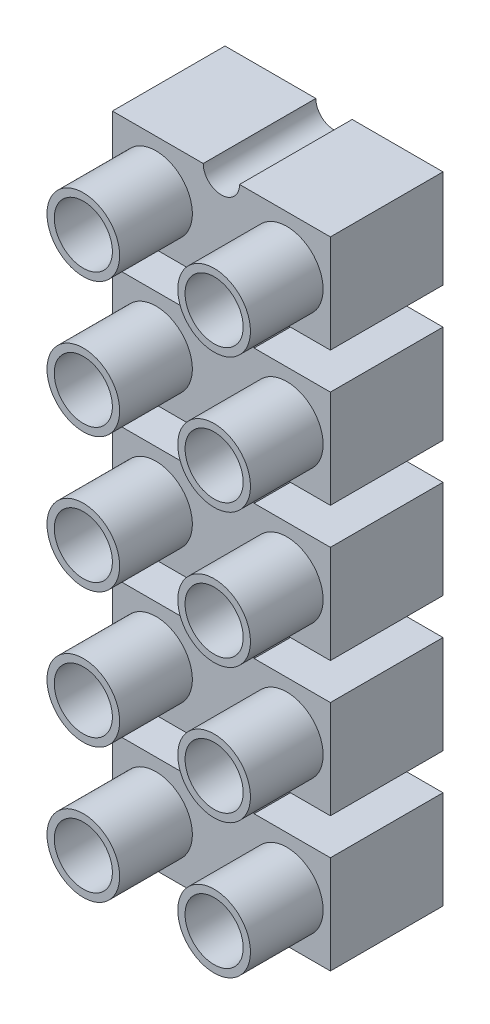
SolidWorks part; units mm, degrees
ref_plane "Plan1" through (0, 0, 0) normal (0, 0, 1) x (1, 0, 0)
ref_plane "Plan2" through (0, 0, 0) normal (0, 1, 0) x (1, 0, 0)
ref_plane "Plan3" through (0, 0, 0) normal (1, 0, 0) x (0, 0, -1)
sketch "Esquisse1" plane through (0, 0, 0) normal (0, 0, 1) x (1, 0, 0)
  line L0 (-15.0042, 29.0042) -> (-15.0042, -20.9546) construction
  line L1 (-22.5042, 29.0042) -> (-16.2542, 29.0042)
  line L2 (-12.7542, 19.7542) -> (-7.5042, 19.7542)
  line L3 (-7.5042, 29.0042) -> (-7.5042, 22.2542)
  line L4 (-7.5042, 22.2542) -> (-12.7542, 22.2542)
  line L5 (-12.7542, 22.2542) -> (-12.7542, 19.7542)
  line L6 (-17.2542, 19.7542) -> (-22.5042, 19.7542)
  line L7 (-17.2542, 22.2542) -> (-17.2542, 19.7542)
  line L8 (-22.5042, 22.2542) -> (-17.2542, 22.2542)
  line L9 (-22.5042, 29.0042) -> (-22.5042, 22.2542)
  line L10 (-7.5042, 19.7542) -> (-7.5042, 13.0042)
  line L11 (-7.5042, 13.0042) -> (-12.7542, 13.0042)
  line L12 (-12.7542, 13.0042) -> (-12.7542, 10.5042)
  line L13 (-12.7542, 10.5042) -> (-7.5042, 10.5042)
  line L14 (-22.5042, 19.7542) -> (-22.5042, 13.0042)
  line L15 (-22.5042, 13.0042) -> (-17.2542, 13.0042)
  line L16 (-17.2542, 13.0042) -> (-17.2542, 10.5042)
  line L17 (-17.2542, 10.5042) -> (-22.5042, 10.5042)
  line L18 (-7.5042, 10.5042) -> (-7.5042, 3.7542)
  line L19 (-7.5042, 3.7542) -> (-12.7542, 3.7542)
  line L20 (-12.7542, 3.7542) -> (-12.7542, 1.2542)
  line L21 (-12.7542, 1.2542) -> (-7.5042, 1.2542)
  line L22 (-22.5042, 10.5042) -> (-22.5042, 3.7542)
  line L23 (-22.5042, 3.7542) -> (-17.2542, 3.7542)
  line L24 (-17.2542, 3.7542) -> (-17.2542, 1.2542)
  line L25 (-17.2542, 1.2542) -> (-22.5042, 1.2542)
  line L26 (-7.5042, 1.2542) -> (-7.5042, -5.4958)
  line L27 (-7.5042, -5.4958) -> (-12.7542, -5.4958)
  line L28 (-12.7542, -5.4958) -> (-12.7542, -7.9958)
  line L29 (-12.7542, -7.9958) -> (-7.5042, -7.9958)
  line L30 (-22.5042, 1.2542) -> (-22.5042, -5.4958)
  line L31 (-22.5042, -5.4958) -> (-17.2542, -5.4958)
  line L32 (-17.2542, -5.4958) -> (-17.2542, -7.9958)
  line L33 (-17.2542, -7.9958) -> (-22.5042, -7.9958)
  line L34 (-7.5042, -7.9958) -> (-7.5042, -14.7458)
  line L35 (-7.5042, -14.7458) -> (-13.7542, -14.7458)
  line L36 (-13.7542, 29.0042) -> (-7.5042, 29.0042)
  line L37 (-15.0042, 21.0042) -> (-7.5042, 21.0042) construction
  line L38 (-22.5042, -7.9958) -> (-22.5042, -14.7458)
  line L39 (-15.0042, 21.0042) -> (-22.5042, 21.0042) construction
  line L40 (-16.2542, -14.7458) -> (-22.5042, -14.7458)
  circle A0 centre (-15.0042, 21.0042) radius 1.25
  circle A1 centre (-15.0042, 11.7542) radius 1.25
  circle A2 centre (-15.0042, 2.5042) radius 1.25
  circle A3 centre (-15.0042, -6.7458) radius 1.25
  arc A4 (-16.2542, 29.0042) -> (-13.7542, 29.0042) centre (-15.0042, 29.0042) ccw
  arc A5 (-13.7542, -14.7458) -> (-16.2542, -14.7458) centre (-15.0042, -14.7458) ccw
  dimension "D7" = 2.5
  dimension "D1" = 6.75
  dimension "D2" = 2.5
  dimension "D3" = 43.75
  dimension "D4" = 15
  dimension "D5" = 8
  dimension "D6" = 5.25
extrude "Base-Extrusion" add sketch "Esquisse1" along normal blind 7.75
sketch "Esquisse2" plane through (0, 0, 7.75) normal (0, 0, 1) x (1, 0, 0)
  line L0 (-16.2542, 29.0042) -> (-22.5042, 29.0042) construction
  line L1 (-15.0042, -6.7458) -> (-15.0042, 32.8287) construction
  circle A0 centre (-10.5042, 25.6342) radius 2.5
  circle A1 centre (-19.5042, 25.6342) radius 2.5
  circle A2 centre (-10.5042, 25.6342) radius 2
  circle A3 centre (-19.5042, 25.6342) radius 2
  circle A4 centre (-10.5042, 16.3842) radius 2
  circle A5 centre (-10.5042, 16.3842) radius 2.5
  circle A6 centre (-19.5042, 16.3842) radius 2.5
  circle A7 centre (-19.5042, 16.3842) radius 2
  circle A8 centre (-10.5042, 7.1342) radius 2
  circle A9 centre (-10.5042, 7.1342) radius 2.5
  circle A10 centre (-19.5042, 7.1342) radius 2.5
  circle A11 centre (-19.5042, 7.1342) radius 2
  circle A12 centre (-10.5042, -2.1158) radius 2
  circle A13 centre (-10.5042, -2.1158) radius 2.5
  circle A14 centre (-19.5042, -2.1158) radius 2.5
  circle A15 centre (-19.5042, -2.1158) radius 2
  circle A16 centre (-10.5042, -11.3658) radius 2
  circle A17 centre (-10.5042, -11.3658) radius 2.5
  circle A18 centre (-19.5042, -11.3658) radius 2.5
  circle A19 centre (-19.5042, -11.3658) radius 2
  dimension "D1" = 5
  dimension "D2" = 3.37
  dimension "D3" = 4.5
  dimension "D4" = 0.5
extrude "Boss.-Extru.1" add sketch "Esquisse2" along normal blind 5
